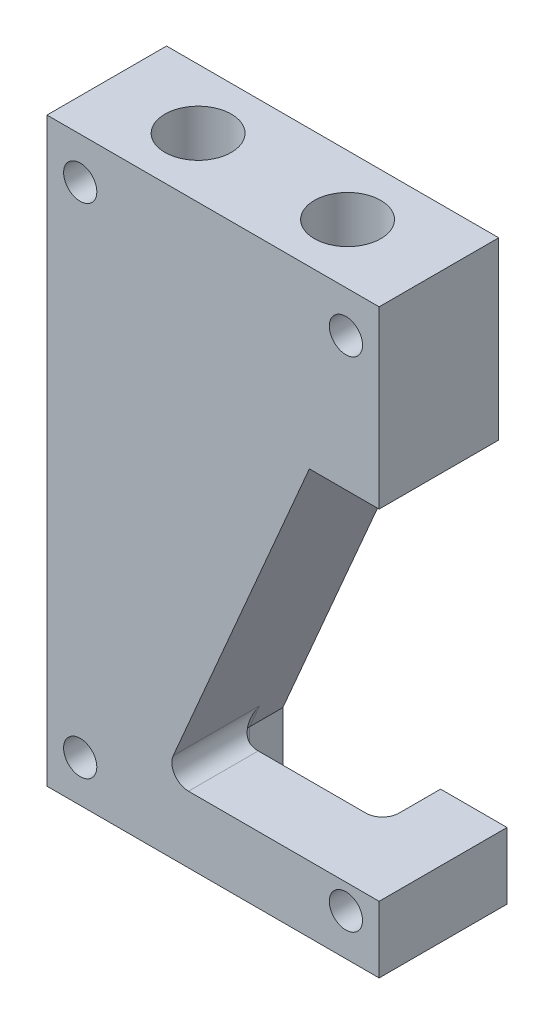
SolidWorks part; units mm, degrees
ref_plane "Ön Düzlem" through (0, 0, 0) normal (0, 0, 1) x (1, 0, 0)
ref_plane "Üst Düzlem" through (0, 0, 0) normal (0, 1, 0) x (1, 0, 0)
ref_plane "Sağ Düzlem" through (0, 0, 0) normal (1, 0, 0) x (0, 0, -1)
sketch "Çizim1" plane through (0, 0, 0) normal (0, 1, 0) x (1, 0, 0)
  line L0 (-10, 3.6) -> (10, -3.6) construction
  line L1 (-10, 3.6) -> (10, 3.6)
  line L2 (-10, 3.6) -> (-10, -3.6)
  line L3 (-10, -3.6) -> (10, -3.6)
  line L4 (10, 3.6) -> (10, -3.6)
  line L5 (10, 3.6) -> (-10, -3.6) construction
  dimension "D1" = 7.2
  dimension "D2" = 20
extrude "Yükseklik-Ekstrüzyon1" add sketch "Çizim1" along normal blind 35
sketch "Çizim2" plane through (0, 35, 0) normal (0, 1, 0) x (1, 0, 0)
  line L0 (-11, 0) -> (11, 0) construction
  line L1 (0, 5.1639) -> (0, -7.6931) construction
  circle A0 centre (-4.5, 0) radius 2
  circle A1 centre (4.5, 0) radius 2
  point P6 (0, 0)
  dimension "D2" = 4
  dimension "D3" = 4
  dimension "D1" = 9
extrude "Kes-Ekstrüzyon1" cut sketch "Çizim2" against normal blind 7
sketch "Çizim3" plane through (0, 0, 3.6) normal (0, 0, 1) x (1, 0, 0)
  line L0 (0, 33.2386) -> (0, -4.439) construction
  line L1 (0, -3.96) -> (0, 3.96) construction
  line L2 (-10, 17.5) -> (24.682, 17.5) construction
  line L3 (-10, 35) -> (-10, 0) construction
  circle A0 centre (-8, 32.5) radius 1
  circle A1 centre (8, 32.5) radius 1
  circle A2 centre (-8, 2.5) radius 1
  circle A3 centre (8, 2.5) radius 1
  point P17 (0, 0)
  point P18 (0, 0)
  dimension "D5" = 2
  dimension "D6" = 2
  dimension "D7" = 2
  dimension "D8" = 2
  dimension "D1" = 16
  dimension "D2" = 16
  dimension "D3" = 30
  dimension "D4" = 30
extrude "Kes-Ekstrüzyon7" cut sketch "Çizim3" against normal through all
sketch "Çizim4" plane through (0, 0, 3.6) normal (0, 0, 1) x (1, 0, 0)
  line L1 (10, 35) -> (10, 0) construction
  line L2 (3.96, 0) -> (-3.96, 0) construction
  line L4 (0, -3.96) -> (0, 3.96) construction
  line L5 (10, 24.45) -> (10, 0)
  line L6 (10, 0) -> (-3, 0)
  line L8 (5.8, 24.45) -> (10, 24.45)
  line L9 (-10, 35) -> (10, 35) construction
  line L10 (-3, 0) -> (-3, 4)
  line L11 (-3, 4) -> (5.8, 24.45)
  dimension "D1" = 10.55
  dimension "D2" = 3
  dimension "D3" = 4.2
  dimension "D4" = 4
extrude "Kes-Ekstrüzyon8" cut sketch "Çizim4" against normal through all
sketch "Çizim6" plane through (-3, 0, 0) normal (1, 0, 0) x (0, 0, -1)
  line L0 (3.96, 0) -> (-3.96, 0) construction
  line L1 (-3.6, 4) -> (0.6, 4)
  line L2 (-3.6, 4) -> (-3.6, 0)
  line L3 (-3.6, 0) -> (0.6, 0)
  line L4 (0.6, 4) -> (0.6, 0)
  dimension "D1" = 4.2
extrude "Yükseklik-Ekstrüzyon2" add sketch "Çizim6" along direction (-1, 0, 0) on the side of the normal blind 13
sketch "Çizim7" plane through (0, 0, -0.6) normal (0, 0, -1) x (-1, 0, 0)
  line L0 (3.96, 0) -> (-3.96, 0) construction
  line L1 (-10, 4) -> (-6, 4)
  line L2 (-10, 4) -> (-10, 0)
  line L3 (-10, 0) -> (-6, 0)
  line L4 (-6, 4) -> (-6, 0)
  dimension "D1" = 4
extrude "Yükseklik-Ekstrüzyon3" add sketch "Çizim7" along normal blind 3.5
sketch "Çizim8" plane through (0, 0, 3.6) normal (0, 0, 1) x (1, 0, 0)
  circle A0 centre (8, 2.5) radius 1
  point P4 (8, 2.5)
  dimension "D1" = 2
extrude "Kes-Ekstrüzyon11" cut sketch "Çizim8" against normal through all
fillet "Radyus3" radius 1 1 edges at (-3, 4, 1.5)
fillet "Radyus4" radius 1 2 edges at (-2.6998, 4.6976, -0.6) (-3, 2, -0.6)
fillet "Radyus5" radius 1 1 edges at (6, 2, -0.6)
